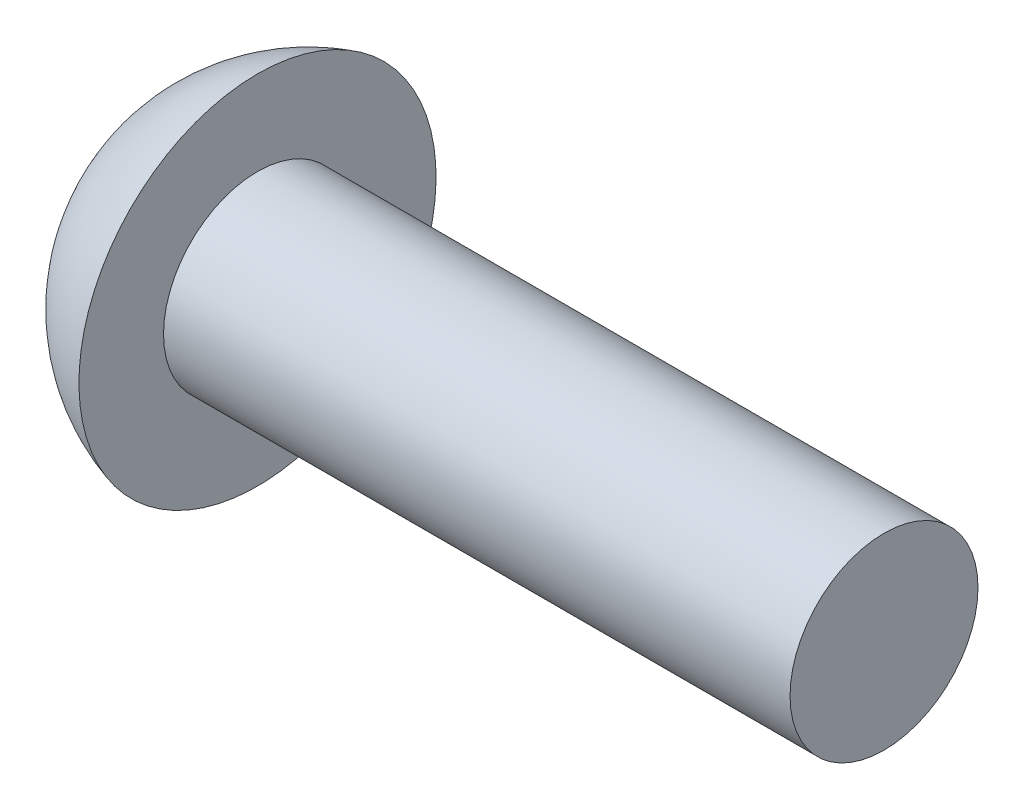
SolidWorks part; units mm, degrees
ref_plane "前视基准面" through (0, 0, 0) normal (0, 0, 1) x (1, 0, 0)
ref_plane "上视基准面" through (0, 0, 0) normal (0, 1, 0) x (1, 0, 0)
ref_plane "右视基准面" through (0, 0, 0) normal (1, 0, 0) x (0, 0, -1)
imported_body "输入1"
sketch "草图1" plane through (1.65, 0, 0) normal (1, 0, 0) x (0, 0, -1)
  circle A0 centre (0, 0) radius 1.5
extrude "凸台-拉伸1" add sketch "草图1" along normal blind 10
